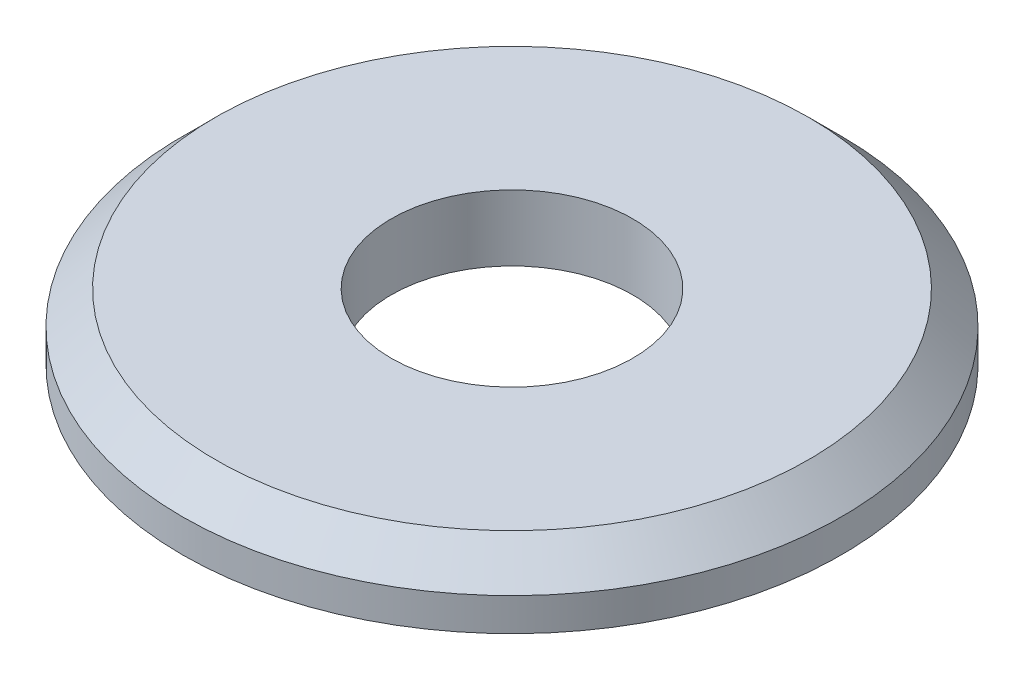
SolidWorks part; units mm, degrees
ref_plane "Front" through (0, 0, 0) normal (0, 0, 1) x (1, 0, 0)
ref_plane "Top" through (0, 0, 0) normal (0, 1, 0) x (1, 0, 0)
ref_plane "Right" through (0, 0, 0) normal (1, 0, 0) x (0, 0, -1)
sketch "Sketch1" plane through (0, 0, 0) normal (0, 1, 0) x (1, 0, 0)
  circle A0 centre (0, 0) radius 0.55
  circle A1 centre (0, 0) radius 1.5
extrude "Extrude1" add sketch "Sketch1" along normal blind 0.3
chamfer "Chamfer1" distance 0.15 1 edges at (0, 0.3, 1.5)
